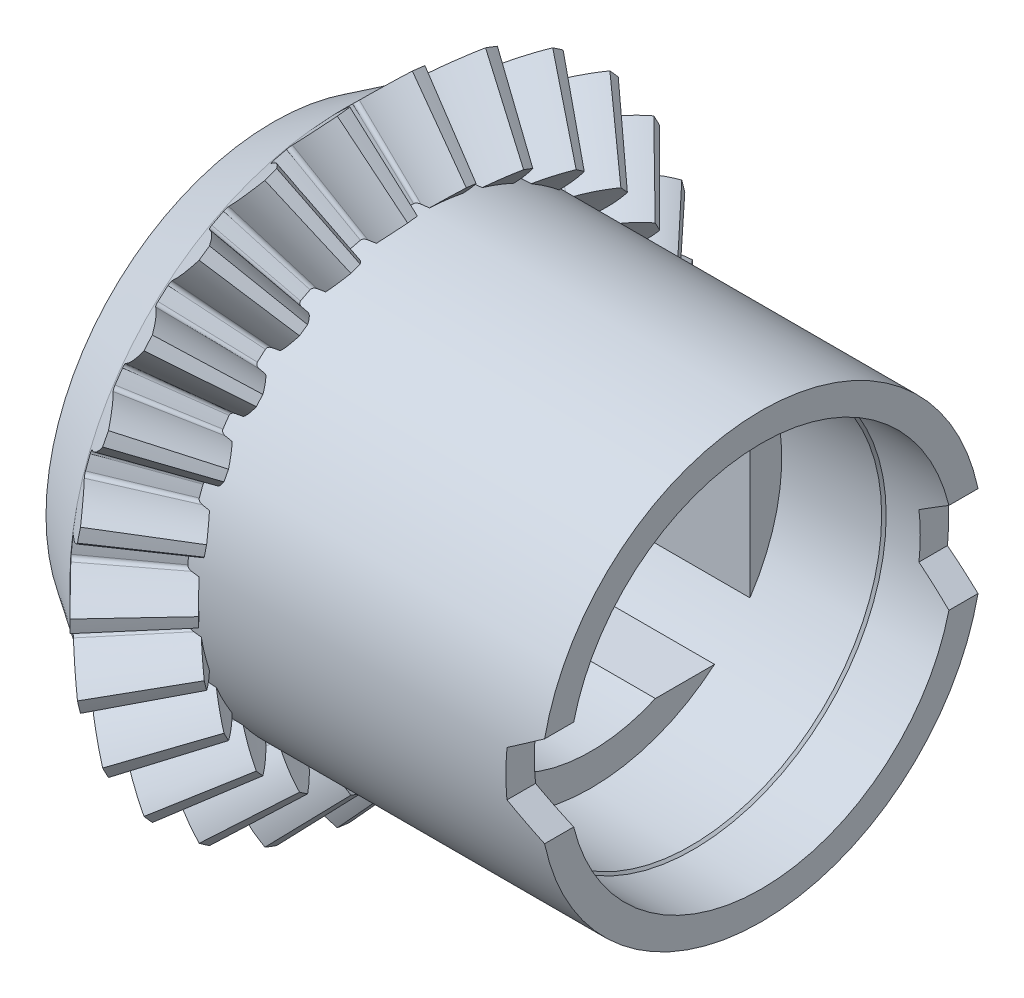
SolidWorks part; units mm, degrees
other "<straight bevel pinion_iso>-<Bore>"
ref_plane "前视基准面" through (0, 0, 0) normal (0, 0, 1) x (1, 0, 0)
ref_plane "上视基准面" through (0, 0, 0) normal (0, 1, 0) x (1, 0, 0)
ref_plane "右视基准面" through (0, 0, 0) normal (1, 0, 0) x (0, 0, -1)
ref_plane "Plane1-straight bevel pinion_iso" through (0, 0, 0) normal (0, 0, 1) x (1, 0, 0)
ref_plane "Plane2-straight bevel pinion_iso" through (0, 0, 0) normal (0, 1, 0) x (1, 0, 0)
ref_plane "Plane3-straight bevel pinion_iso" through (0, 0, 0) normal (1, 0, 0) x (0, 0, -1)
sketch "HoldingSke-straight bevel pinion_iso" plane through (0, 0, 0) normal (0, 1, 0) x (1, 0, 0)
  line L0 (0, 0) -> (0.8988, -0.4384)
  line L1 (-15, 0) -> (100, 0) construction
  line L2 (0, 0) -> (-103.1458, 51.0161)
  line L3 (0, 0) -> (-11.863, 4.5341)
  line L4 (0, 0) -> (7.762, 3.7858)
  line L5 (0, 0) -> (-46.8476, -17.4728)
  line L6 (0, 0) -> (-10.5278, -7.1032)
  line L7 (-103.1458, 51.0161) -> (-90.6858, 99.4387)
  line L8 (-76.2, 1) -> (-75.5, 1)
  line L9 (-71.009, 38.7566) -> (-53.1078, 45.2721)
  line L10 (-76.2, 71.12) -> (104.1128, 71.12)
  line L11 (0, 0) -> (-4, 0)
  line L12 (-76.2, 101.6) -> (-76.162, 101.6)
  line L13 (24.9733, 27.94) -> (52.9518, 28.4284)
  line L14 (24.9733, 27.94) -> (24.9743, 27.94)
  line L15 (24.9733, 27.94) -> (100.4024, 29.5042)
  line L16 (-103.1458, 51.0161) -> (12.8951, -5.5808)
  circle A0 centre (0, 0) radius 2
  circle A1 centre (0, 0) radius 5
  circle A2 centre (0, 0) radius 5
  circle A3 centre (0, 0) radius 2
  dimension "MHD" = 10
  dimension "Hub_dia" = 10
  dimension "Bore" = 4
  dimension "MBD" = 4
  dimension "Num_teeth" = 26
  dimension "Pitch_radius" = 180.3128
  dimension "Pitch" = 1
  dimension "Width" = 4
  dimension "Mounting_dist" = 50
  dimension "Show_teeth" = 26
  dimension "Thickness" = 12.7
  dimension "OAL" = 50.0001
  dimension "T_dim" = 0.7
  dimension "Ap" = 20
  dimension "H" = 19.05
  dimension "Backlash" = 0.038
  dimension "Addendum_fac" = 1
  dimension "Dedendum_fac" = 1.188
  dimension "Clearance_fac" = 0.188
  dimension "Dedendum_add" = 0.001
  dimension "Mating_teeth" = 26
  dimension "MnMD" = 14.0509
  dimension "Module" = 1
sketch "BasProSke-straight bevel pinion_iso" plane through (0, 0, 0) normal (0, 1, 0) x (1, 0, 0)
  line L0 (-10, 0) -> (60, 0) construction
  line L1 (0, 0) -> (0, 11.9491)
  line L2 (0, 0) -> (3.0571, 0)
  line L3 (3.0571, 0) -> (3.0571, 9.3493)
  line L4 (14.0509, 0) -> (-21.3711, 35.422) construction
  line L5 (0, 11.9491) -> (1.758, 13.7071)
  line L6 (14.0509, 0) -> (-53.2204, 75.0104) construction
  line L7 (14.0509, 0) -> (0, 11.9491) construction
  line L8 (1.758, 13.7071) -> (4.4326, 10.7248)
  line L9 (4.4326, 10.7248) -> (3.0571, 9.3493)
  line L10 (1.0509, 13) -> (-10.9334, 13) construction
  dimension "D2" = 14.0509
  dimension "D3" = 18.3848
  dimension "D1" = 23.8981
  dimension "D4" = 3.113
  dimension "Addendum" = 1
  dimension "Pitch_rad" = 13
  dimension "Dedendum_plus" = 1.4863
  dimension "Face_wid" = 4
  dimension "Pitch_ang" = 45
ref_plane "ToothPln-straight bevel pinion_iso" through (0.879, 12.8281, 0) normal (-0.7071, 0.7071, 0) x (0, 0, -1)
ref_plane "ToothPln2-straight bevel pinion_iso" through (7.0255, -7.0255, 0) normal (-0.7071, 0.7071, 0) x (0, 0, 1)
sketch "TooCutSke-straight bevel pinion_iso" plane through (0.879, 12.8281, 0) normal (-0.7071, 0.7071, 0) x (0, 0, -1)
  line L2 (0, 12.7569) -> (202.8806, -1658.1154) construction
  line L3 (0, 12.7569) -> (109.9014, -1761.0343) construction
  line L4 (0, -15.621) -> (0, 105.791) construction
  line L6 (-24.765, -1.2431) -> (21.082, -1.2431) construction
  line L7 (1.567, -0.1483) -> (0.8025, -0.1957) construction
  arc A0 (-1.567, -1.4369) -> (1.567, -1.4369) centre (0, 12.7569) ccw
  arc A1 (-0.2933, 0.9495) -> (0.2933, 0.9495) centre (0, 12.7569) ccw
  circle A2 centre (0, 12.7569) radius 13 construction
  circle A3 centre (0, 12.7569) radius 12.216 construction
  arc A4 (0.4828, 0.8) -> (0.2933, 0.9495) centre (0.298, 0.7606) ccw
  arc A5 (0.4828, 0.8) -> (1.567, -1.4369) centre (5.5686, 1.8839) ccw
  arc A6 (-1.567, -1.4369) -> (-0.4828, 0.8) centre (-5.5686, 1.8839) ccw
  arc A7 (-0.2933, 0.9495) -> (-0.4828, 0.8) centre (-0.298, 0.7606) ccw
  dimension "Overcut_dia" = 28.56
  dimension "Root_dia" = 23.622
  dimension "Pitch_dia" = 26
  dimension "Base_dia" = 24.432
  dimension "Flank_rad" = 5.2
  dimension "Root_fillet" = 0.189
  dimension "Radius" = 14
  dimension "Half_ang" = 6.923
  dimension "Half_CT" = 0.7659
sketch "TooCutSke2-straight bevel pinion_iso" plane through (7.0255, -7.0255, 0) normal (-0.7071, 0.7071, 0) x (0, 0, 1)
  line L0 (0, 0) -> (0, 68.072) construction
  line L2 (21.082, 8.4493) -> (-20.32, 8.4493) construction
  circle A0 centre (0, 9.9355) radius 0.0127
  dimension "Diameter" = 0.0254
  dimension "Dedendum_plus" = 1.4863
sketch "HubSke-straight bevel pinion_iso" plane through (0, 0, 0) normal (-1, 0, 0) x (0, 0, 1)
  circle A0 centre (0, 0) radius 5
  dimension "Diameter" = 10
sketch "BorSke-straight bevel pinion_iso" plane through (0, 0, 0) normal (1, 0, 0) x (0, 0, -1)
  circle A0 centre (0, 0) radius 2
  dimension "Diameter" = 4
sketch "KeySke-straight bevel pinion_iso" [suppressed] plane through (0, 0, 0) normal (1, 0, 0) x (0, 0, -1)
  line L0 (-3.175, 0) -> (-3.175, 2.7)
  line L1 (-3.175, 2.7) -> (-1.575, 2.7)
  line L2 (-1.575, 2.7) -> (-1.575, 0)
  line L3 (-2.375, 0) -> (-2.375, 34) construction
  line L4 (-3.175, 0) -> (-1.575, 0)
  dimension "Offset" = 2.7
  dimension "Width" = 1.6
inserted part "straight bevel pinion_iso" parameters "Num_teeth.HoldingSke"=26, "Pitch.HoldingSke"=1, "MHD.HoldingSke"=10, "Hub_dia.HoldingSke"=10, "Mounting_dist.HoldingSke"=50, "Show_teeth.HoldingSke"=26, "Thickness.HoldingSke"=12.7, "OAL.HoldingSke"=50.0001, "T_dim.HoldingSke"=0.7, "Ap.HoldingSke"=20, "H.HoldingSke"=19.05, "Pitch_radius.HoldingSke"=180.3128, "Width.HoldingSke"=4, "Bore.HoldingSke"=4, "Backlash.HoldingSke"=0.038, "Addendum_fac.HoldingSke"=1, "Dedendum_fac.HoldingSke"=1.188, "Clearance_fac.HoldingSke"=0.188, "Dedendum_add.HoldingSke"=0.001, "Mating_teeth.HoldingSke"=26, "MnMD.HoldingSke"=14.0509, "MBD.HoldingSke"=4, "Module.HoldingSke"=1, "D1.Base-Revolve"=360, "Addendum.BasProSke"=1, "Pitch_rad.BasProSke"=13, "Dedendum_plus.BasProSke"=1.4863, "Face_wid.BasProSke"=4, "Pitch_ang.BasProSke"=45, "D1.BasProSke"=23.8981, "D2.BasProSke"=14.0509, "D3.BasProSke"=18.3848, "D4.BasProSke"=3.113, "Offset.ToothPln2"=18.3848, "Dedendum_plus.TooCutSke2"=1.4863, "Diameter.TooCutSke2"=0.0254, "Radius.TooCutSke"=14, "Overcut_dia.TooCutSke"=28.56, "Root_dia.TooCutSke"=23.622, "Pitch_dia.TooCutSke"=26, "Base_dia.TooCutSke"=24.432, "Half_ang.TooCutSke"=6.923, "Half_CT.TooCutSke"=0.7659, "Flank_rad.TooCutSke"=5.2, "Root_fillet.TooCutSke"=0.189, "Angle.TeethCuts"=13.846, "Num_teeth.TeethCuts"=26, "Length.Hub"=35.9492, "Diameter.HubSke"=10, "D1.Bore"=100.0001, "Diameter.BorSke"=4
move or copy body "实体-移动/复制4" placed by mates yes
sketch "草图17" plane through (0, 0, 0) normal (-1, 0, 0) x (0, 0, 1)
  circle A0 centre (0, 0) radius 5
extrude "切除-拉伸1" cut sketch "草图17" along normal up to next
sketch "草图18" plane through (0, 0, 0) normal (-1, 0, 0) x (0, 0, 1)
  line L0 (0, 0) -> (0, 11.9491) construction
  circle A0 centre (0, 0) radius 11.9491
ref_plane "基准面13" through (-3, 0, 0) normal (-1, 0, 0) x (0, 0, 1)
sketch "草图19" plane through (-3, 0, 0) normal (-1, 0, 0) x (0, 0, 1)
  line L0 (0, 0) -> (0, 10) construction
  circle A0 centre (0, 0) radius 10
  dimension "D1" = 20
loft "放样1" add profiles "草图18", "草图19"
sketch "草图21" plane through (-3, 0, 0) normal (-1, 0, 0) x (0, 0, 1)
  circle A0 centre (0, 0) radius 9.75
  dimension "D1" = 19.5
extrude "凸台-拉伸1" add sketch "草图21" against normal blind 21.5
sketch "草图22" plane through (-3, 0, 0) normal (-1, 0, 0) x (0, 0, 1)
  circle A0 centre (0, 0) radius 8.5
  dimension "D1" = 17
extrude "切除-拉伸2" cut sketch "草图22" against normal blind 3
sketch "草图23" plane through (18.5, 0, 0) normal (1, 0, 0) x (0, 0, -1)
  circle A0 centre (0, 0) radius 8.5
  dimension "D1" = 17
extrude "切除-拉伸3" cut sketch "草图23" against normal blind 3
sketch "草图24" plane through (0, 0, 0) normal (-1, 0, 0) x (0, 0, 1)
  circle A0 centre (0, 0) radius 8.4
  dimension "D1" = 16.8
extrude "切除-拉伸4" cut sketch "草图24" against normal blind 4.5
sketch "草图25" plane through (15.5, 0, 0) normal (1, 0, 0) x (0, 0, -1)
  circle A0 centre (0, 0) radius 8.4
  dimension "D1" = 16.8
extrude "切除-拉伸5" cut sketch "草图25" against normal blind 4.5
sketch "草图26" plane through (11, 0, 0) normal (1, 0, 0) x (0, 0, -1)
  line L0 (0, 8.4) -> (0, -8.4) construction
  line L1 (5.4406, 6.4) -> (2.8355, 6.4)
  line L2 (5.4406, -6.4) -> (2.8355, -6.4)
  line L3 (-7, 4.6433) -> (-7, -4.6433)
  line L4 (7, 4.6433) -> (7, -4.6433)
  line L6 (-2.8355, 6.4) -> (-5.4406, 6.4)
  line L7 (-7, 8.4) -> (-7, -8.4) construction
  line L8 (-2.8355, -6.4) -> (-5.4406, -6.4)
  line L9 (7, 8.4) -> (7, -8.4) construction
  circle A0 centre (0, 0) radius 8.4 construction
  arc A1 (5.4406, -6.4) -> (7, -4.6433) centre (0, 0) ccw
  arc A2 (2.8355, 6.4) -> (-2.8355, 6.4) centre (0, 0) ccw
  arc A3 (-5.4406, 6.4) -> (-7, 4.6433) centre (0, 0) ccw
  arc A4 (-2.8355, -6.4) -> (2.8355, -6.4) centre (0, 0) ccw
  arc A5 (-7, -4.6433) -> (-5.4406, -6.4) centre (0, 0) ccw
  arc A6 (7, 4.6433) -> (5.4406, 6.4) centre (0, 0) ccw
  dimension "D1" = 7
  dimension "D3" = 16.8
  dimension "D2" = 7
extrude "切除-拉伸7" cut sketch "草图26" against normal up to next
sketch "草图27" plane through (0, 0, -7) normal (0, 0, 1) x (1, 0, 0)
  line L0 (7.75, 4.6433) -> (7.75, -4.6433) construction
  line L1 (4.5, 4.6433) -> (11, 4.6433) construction
  line L2 (4.5, -4.6433) -> (11, -4.6433) construction
  circle A0 centre (7.75, 0) radius 1.8
  dimension "D1" = 3.6
extrude "凸台-拉伸2" add sketch "草图27" along normal blind 3
chamfer "倒角1" distance 0.5 angle 45 1 edges at (9.55, 0, -4)
chamfer "倒角2" distance 0.1 angle 45 2 edges at (15.5, 0, -8.4) (0, 0, 8.4)
chamfer "倒角3" distance 0.2 angle 45 1 edges at (-3, 0, 8.5)
mirror "镜向1" about plane through (0, 0, 0) normal (0, 0, 1) of "倒角1", "凸台-拉伸2"
sketch "草图28" plane through (0, 0, 0) normal (0, 0, 1) x (1, 0, 0)
  line L0 (18.5, 0) -> (17, 0) construction
  line L1 (18.5, -9.75) -> (18.5, 9.75) construction
  line L2 (17, -1) -> (17, 1)
  line L3 (17, 1) -> (18.5, 2)
  line L4 (18.5, 2) -> (18.5, -2)
  line L5 (17, -1) -> (18.5, -2)
  dimension "D1" = 1.5
  dimension "D2" = 1
  dimension "D3" = 2
extrude "切除-拉伸8" cut sketch "草图28" against normal up to next and the other way up to next
